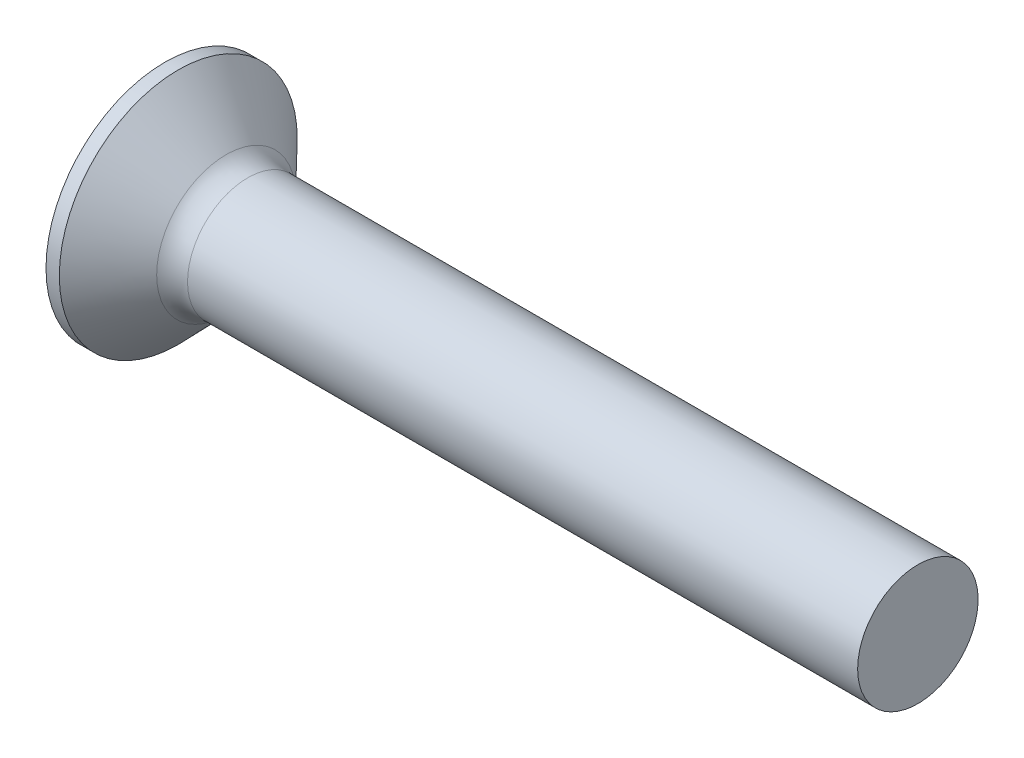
SolidWorks part; units mm, degrees
ref_plane "Front Plane" through (0, 0, 0) normal (0, 0, 1) x (1, 0, 0)
ref_plane "Top Plane" through (0, 0, 0) normal (0, 1, 0) x (1, 0, 0)
ref_plane "Right Plane" through (0, 0, 0) normal (1, 0, 0) x (0, 0, -1)
sketch "BodySke" plane through (0, 0, 0) normal (0, 0, 1) x (1, 0, 0)
  line L0 (0, 0) -> (111.3824, 0) construction
  line L1 (0, 0) -> (0, 7.9)
  line L2 (0, 7.9) -> (0.8838, 7.9)
  line L3 (0.8838, 7.9) -> (4.65, 4)
  line L4 (4.65, 4) -> (50, 4)
  line L5 (50, 4) -> (50, 0)
  line L6 (5.9, 7.824) -> (5.9, -6.8939) construction
  line L7 (0, 0) -> (50, 0)
  line L8 (7.15, 8.824) -> (7.15, -4.958) construction
  line L9 (0, -7.9) -> (0.8838, -7.9) construction
  line L10 (0.8838, -7.9) -> (4.65, -4) construction
  line L11 (4.65, -4) -> (50, -4) construction
  point P10 (50, 3.4455)
  dimension "Diameter" = 8
  dimension "Head_dia" = 15.8
  dimension "Head_height" = 4.65
  dimension "Length" = 50
  dimension "Advance" = 1.25
  dimension "Thread_minor" = 6.891
  dimension "Head_ang" = 92
  dimension "Thread_runout" = 2.5
revolve "BaseBody" add sketch "BodySke" angle 360 about L0
fillet "Fillet1" radius 2 1 edges at (4.65, 0, 4)
ref_plane "Plane1" through (4.96, 0, 0) normal (1, 0, 0) x (0, 0, -1)
sketch "RecSkeTop" plane through (0, 0, 0) normal (-1, 0, 0) x (0, 0, 1)
  line L1 (-0.968, 4.4) -> (0.968, 4.4)
  line L2 (-0.968, 4.4) -> (-0.968, -4.4)
  line L3 (-0.968, -4.4) -> (0.968, -4.4)
  line L4 (0.968, 4.4) -> (0.968, -4.4)
  dimension "D1" = 4.4
  dimension "Cross_dia" = 8.8
  dimension "D2" = 1.936
  dimension "D3" = 0.968
sketch "RecSkeBot" plane through (4.96, 0, 0) normal (1, 0, 0) x (0, 0, -1)
  line L0 (0.968, 4.4) -> (0.968, -4.4) construction
  line L1 (0.968, 1.927) -> (-0.968, 1.927)
  line L2 (0.968, 1.927) -> (0.968, -1.927)
  line L3 (0.968, -1.927) -> (-0.968, -1.927)
  line L4 (-0.968, 1.927) -> (-0.968, -1.927)
  line L5 (-0.968, 4.4) -> (-0.968, -4.4) construction
  dimension "D1" = 3.8541
  dimension "D2" = 1.927
loft "Recess" cut profiles "RecSkeTop", "RecSkeBot"
pattern_circular "RecPat" count 2 every 90 about axis through (0, 0, 0) along (1, 0, 0) of "Recess"
sketch "RecCorSke" plane through (0, 0, 0) normal (0, 0, 1) x (1, 0, 0)
  line L0 (0, 0) -> (57.5987, 0) construction
  line L1 (0, 0) -> (0, 2.1296)
  line L2 (0, 7.9) -> (0, -7.9) construction
  line L3 (0, 2.1296) -> (4.96, 1.7828)
  line L4 (4.96, 1.7828) -> (5.5393, 0)
  line L5 (5.5393, 0) -> (0, 0)
  dimension "D1" = 18
  dimension "D2" = 4.96
  dimension "D3" = 2.1296
  dimension "D4" = 4
revolve "RecessCore" cut sketch "RecCorSke" angle 360 about L0
sketch "ThdSchSke" plane through (0, 0, 0) normal (0, 0, 1) x (1, 0, 0)
  line L0 (0, 0) -> (55.1256, 0) construction
  line L1 (0, 0) -> (111.3824, 0) construction
  line L2 (49.6799, 4) -> (49.6799, 4.6403)
  line L3 (49.6799, 4.6403) -> (50.3201, 4.6403)
  line L4 (50.3201, 4.6403) -> (50.3201, 4)
  line L5 (50.3201, 4) -> (50, 3.4455)
  line L6 (50, 3.4455) -> (49.6799, 4)
  line L7 (4.65, 4) -> (50, 4) construction
  line L13 (50, 4) -> (50, 0) construction
revolve "ThreadSchematic" [suppressed] cut sketch "ThdSchSke" angle 360 about L0
pattern_linear "ThdSchPat" [suppressed] count 35 along (1, 0, 0)
equation "\"Thread_minor@ThreadCosmetic\" = \"Thread_minor@BodySke\""
equation "\"D1@RecSkeTop\" = \"Cross_dia@RecSkeTop\" / 2"
equation "\"D2@RecSkeTop\" = \"Cross_dia@RecSkeTop\" * 0.22"
equation "\"D3@RecSkeTop\" = \"D2@RecSkeTop\" / 2"
equation "\"D1@RecSkeBot\" = \"Cross_dia@RecSkeTop\" - 2 * \"Cross_depth@Plane1\" *  tan( 26.5 * 0.017453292 ) "
equation "\"D2@RecSkeBot\" = \"D1@RecSkeBot\" / 2"
equation "\"D2@RecCorSke\" = \"Cross_depth@Plane1\""
equation "\"D3@RecCorSke\" = \"D2@RecSkeTop\" * 1.1"
equation "\"Advance@ThdSchPat\" = \"Advance@BodySke\""
equation "\"D1@ThdSchPat\" =  int( ( \"Length@BodySke\" - \"Head_height@BodySke\" - \"Thread_runout@BodySke\" )  / \"Advance@ThdSchPat\" )  + 1"
